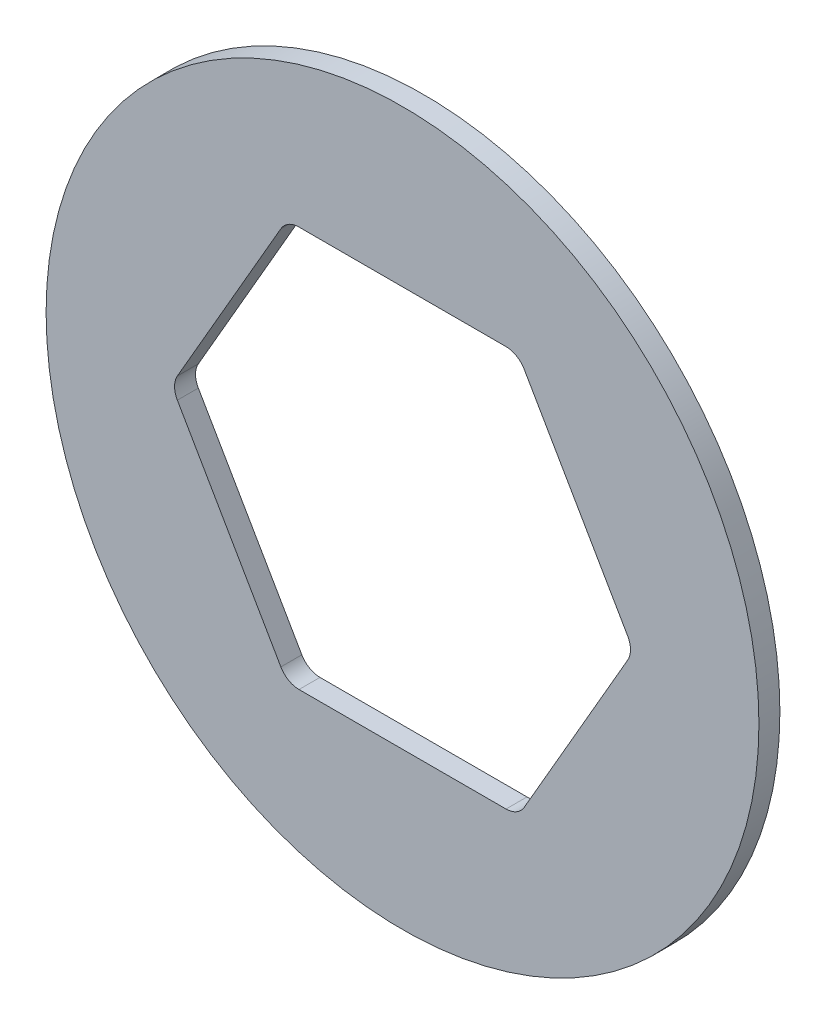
SolidWorks part; units mm, degrees
ref_plane "Plan1" through (0, 0, 0) normal (0, 0, 1) x (1, 0, 0)
ref_plane "Plan2" through (0, 0, 0) normal (0, 1, 0) x (1, 0, 0)
ref_plane "Plan3" through (0, 0, 0) normal (1, 0, 0) x (0, 0, -1)
sketch "Esquisse1" plane through (0, 0, 0) normal (0, 0, 1) x (1, 0, 0)
  line L1 (5.5137, -9.55) -> (11.0274, 0)
  line L2 (11.0274, 0) -> (5.5137, 9.55)
  line L3 (5.5137, 9.55) -> (-5.5137, 9.55)
  line L4 (-5.5137, 9.55) -> (-11.0274, 0)
  line L5 (-11.0274, 0) -> (-5.5137, -9.55)
  line L6 (-5.5137, -9.55) -> (5.5137, -9.55)
  circle A0 centre (0, 0) radius 9.55 construction
  circle A1 centre (0, 0) radius 17
  dimension "D1" = 19.1
  dimension "D2" = 34
extrude "Boss.-Extru.1" add sketch "Esquisse1" along normal blind 1
sketch "Esquisse2" plane through (0, 0, 1) normal (0, 0, 1) x (1, 0, 0)
  line L0 (0, -50) -> (0, 50) construction
  line L2 (-2.1, 16.2939) -> (-2.1, 15)
  line L4 (2.1, 16.2939) -> (2.1, 15)
  arc A0 (-2.1, 15) -> (2.1, 15) centre (0, 15) ccw
  circle A1 centre (0, 0) radius 15 construction
  circle A2 centre (0, 0) radius 17 construction
  arc A3 (2.6788, 16.7876) -> (-2.6788, 16.7876) centre (0, 0) ccw
  arc A4 (2.1, 16.2939) -> (2.6788, 16.7876) centre (2.6, 16.2939) cw
  arc A5 (-2.1, 16.2939) -> (-2.6788, 16.7876) centre (-2.6, 16.2939) ccw
  dimension "D2" = 2
  dimension "D3" = 0.5
  dimension "D1" = 4.2
extrude "Enlèv. mat.-Extru.1" [suppressed] cut sketch "Esquisse2" against normal through all
pattern_circular "Répétition circulaire1" [suppressed] count 12 over 360
fillet "Congé1" radius 1 6 edges at (11.0274, 0, 0.5) (5.5137, -9.55, 0.5) (-5.5137, -9.55, 0.5) (-11.0274, 0, 0.5) (-5.5137, 9.55, 0.5) (5.5137, 9.55, 0.5)
